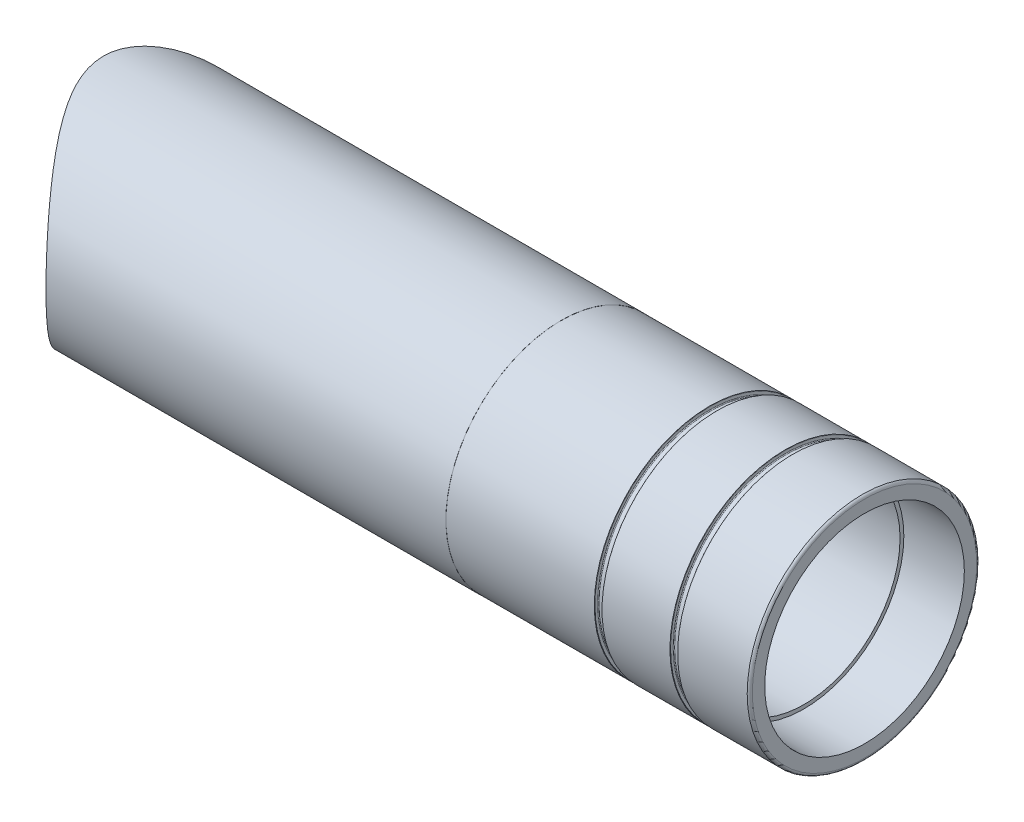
SolidWorks part; units mm, degrees
ref_plane "Front Plane" through (0, 0, 0) normal (0, 0, 1) x (1, 0, 0)
ref_plane "Top Plane" through (0, 0, 0) normal (0, 1, 0) x (1, 0, 0)
ref_plane "Right Plane" through (0, 0, 0) normal (1, 0, 0) x (0, 0, -1)
sketch "Sketch1" plane through (0, 0, 0) normal (1, 0, 0) x (0, 0, -1)
  circle A0 centre (0, 0) radius 31.75
  circle A1 centre (0, 0) radius 38.1
  dimension "D1" = 63.5
  dimension "D2" = 76.2
extrude "Boss-Extrude1" add sketch "Sketch1" against normal blind 150 and the other way blind 130
sketch "Sketch2" plane through (0, 0, 0) normal (0, 0, 1) x (1, 0, 0)
  line L0 (-150, 38.1) -> (-150, -38.1) construction
  circle A0 centre (-150, 0) radius 47.5
  dimension "D1" = 95
extrude "Cut-Extrude1" cut sketch "Sketch2" against normal up to next and the other way up to next
ref_plane "Plane1" through (0, 0, 38.1) normal (0, 0, 1) x (1, 0, 0)
fillet "Fillet1" radius 1 1 edges at (130, 0, -38.1)
sketch "Sketch5" plane through (0, 0, 0) normal (0, 0, 1) x (1, 0, 0)
  line L0 (129, 38.1) -> (-121.6338, 38.1) construction
  line L1 (103.7935, 39.3825) -> (106.2065, 39.3825)
  line L2 (103.7935, 39.3825) -> (103.7935, 37.0715)
  line L3 (104.0475, 36.8175) -> (105.9525, 36.8175)
  line L4 (106.2065, 39.3825) -> (106.2065, 37.0715)
  line L5 (103.7935, 39.3825) -> (106.2065, 36.8175) construction
  line L6 (103.7935, 36.8175) -> (106.2065, 39.3825) construction
  line L7 (130, -37.1) -> (130, 37.1) construction
  line L8 (78.7935, 39.3547) -> (81.2065, 39.3547)
  line L9 (78.7935, 39.3547) -> (78.7935, 37.0437)
  line L10 (79.0475, 36.7897) -> (80.9525, 36.7897)
  line L11 (81.2065, 39.3547) -> (81.2065, 37.0437)
  line L12 (78.7935, 39.3547) -> (81.2065, 36.7897) construction
  line L13 (78.7935, 36.7897) -> (81.2065, 39.3547) construction
  line L14 (105, 38.1) -> (80, 38.0722) construction
  arc A0 (105.9525, 36.8175) -> (106.2065, 37.0715) centre (105.9525, 37.0715) ccw
  arc A1 (104.0475, 36.8175) -> (103.7935, 37.0715) centre (104.0475, 37.0715) cw
  arc A2 (80.9525, 36.7897) -> (81.2065, 37.0437) centre (80.9525, 37.0437) ccw
  arc A3 (79.0475, 36.7897) -> (78.7935, 37.0437) centre (79.0475, 37.0437) cw
  point P0 (105, 38.1)
  point P16 (80, 38.0722)
  dimension "D4" = 0.254
  dimension "D1" = 2.565
  dimension "D2" = 2.413
  dimension "D3" = 25
  dimension "D6" = 25
  dimension "D5" = 2
ref_axis "Axis1" through (130, 0, 0) along (-1, 0, 0)
revolve "Cut-Revolve1" cut sketch "Sketch5" angle 360 about axis through (130, 0, 0) along (-1, 0, 0)
fillet "Fillet2" radius 0.1778 4 edges at (106.2065, 0, -38.1) (103.7935, 0, 38.1) (81.2065, 0, -38.1) (78.7935, 0, 38.1)
ref_plane "Plane2" through (-150, 0, 0) normal (1, 0, 0) x (0, 0, -1)
sketch "Sketch6" plane through (-150, 0, 0) normal (1, 0, 0) x (0, 0, -1)
  circle A0 centre (0, 0) radius 33
  dimension "D1" = 66
extrude "Cut-Extrude2" cut sketch "Sketch6" along normal blind 70
ref_plane "Plane3" through (-93, 0, 0) normal (-1, 0, 0) x (0, 0, 1)
sketch "Sketch8" plane through (130, 0, 0) normal (1, 0, 0) x (0, 0, -1)
  circle A0 centre (0, 0) radius 33
extrude "Cut-Extrude4" cut sketch "Sketch8" against normal blind 20
ref_plane "Plane4" through (123, 0, 0) normal (1, 0, 0) x (0, 0, -1)
sketch "Sketch9" plane through (130, 0, 0) normal (1, 0, 0) x (0, 0, -1)
  circle A0 centre (0, 0) radius 38.0615
  dimension "D1" = 76.123
extrude "Cut-Extrude5" cut sketch "Sketch9" against normal blind 100.3 flip side to cut
